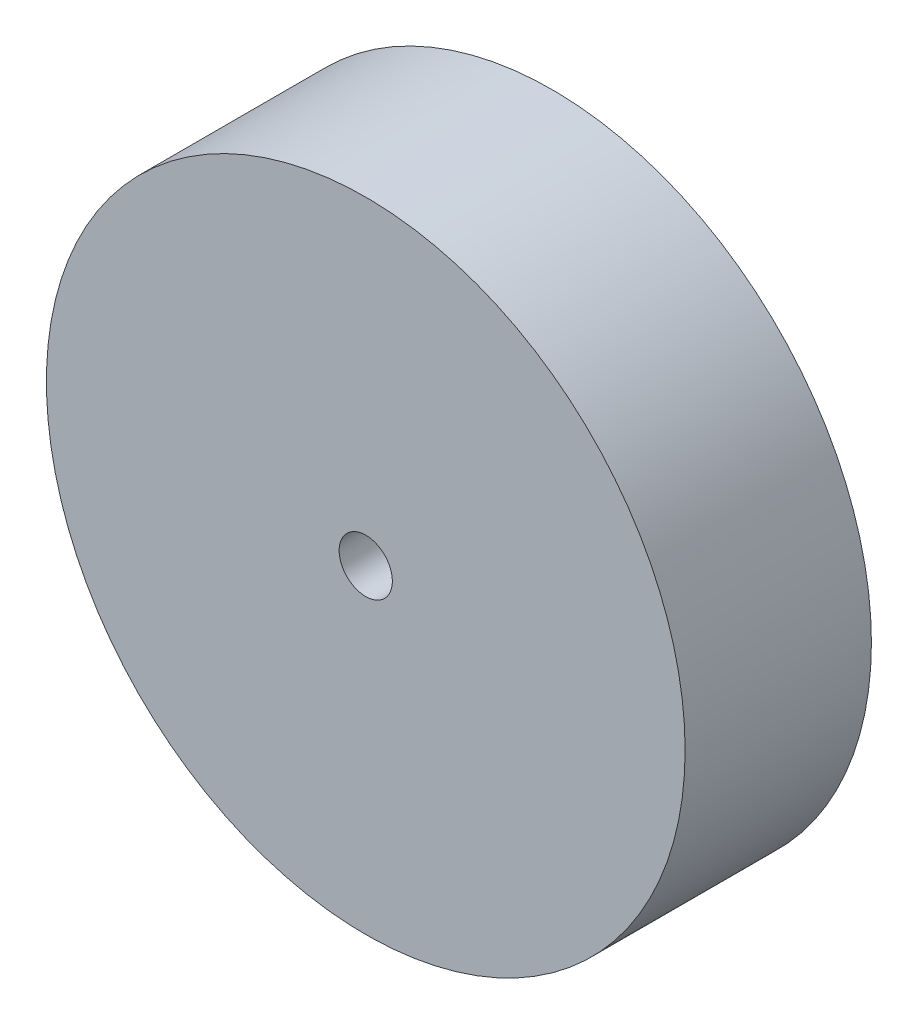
SolidWorks part; units mm, degrees
ref_plane "Front Plane" through (0, 0, 0) normal (0, 0, 1) x (1, 0, 0)
ref_plane "Top Plane" through (0, 0, 0) normal (0, 1, 0) x (1, 0, 0)
ref_plane "Right Plane" through (0, 0, 0) normal (1, 0, 0) x (0, 0, -1)
sketch "Sketch1" plane through (0, 0, 0) normal (0, 0, 1) x (1, 0, 0)
  circle A0 centre (0, 0) radius 38.1
  dimension "D1" = 76.2
extrude "Boss-Extrude1" add sketch "Sketch1" along normal blind 22.225
sketch "Sketch2" plane through (0, 0, 22.225) normal (0, 0, 1) x (1, 0, 0)
  circle A0 centre (0, 0) radius 3.175
  dimension "D1" = 6.35
extrude "Cut-Extrude1" cut sketch "Sketch2" against normal through all contours A0
